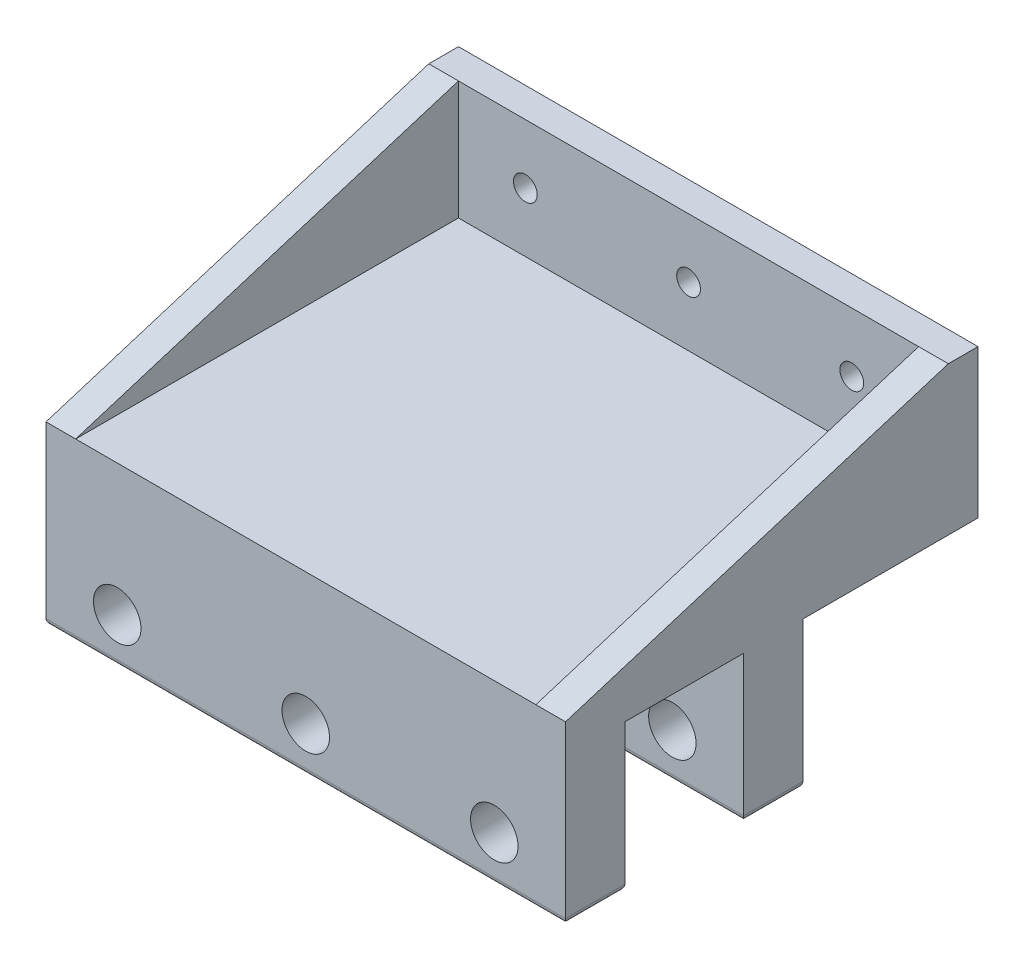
SolidWorks part; units mm, degrees
ref_plane "Front Plane" through (0, 0, 0) normal (0, 0, 1) x (1, 0, 0)
ref_plane "Top Plane" through (0, 0, 0) normal (0, 1, 0) x (1, 0, 0)
ref_plane "Right Plane" through (0, 0, 0) normal (1, 0, 0) x (0, 0, -1)
sketch "Sketch1" plane through (0, 0, 0) normal (0, 0, 1) x (1, 0, 0)
  line L0 (47.6629, 9.1457) -> (47.6644, 47.1838) construction
  line L1 (47.6629, -7.5399) -> (47.6629, 0)
  line L2 (15.8937, -7.5399) -> (79.4322, -7.5399)
  line L3 (47.6629, 9.1457) -> (47.6629, -7.5399)
  line L4 (47.6644, 47.1838) -> (135.2628, 47.1838) construction
  line L10 (91.4322, 22.1643) -> (91.4322, -7.5399)
  line L11 (91.4322, -7.5399) -> (79.4322, -7.5399)
  line L13 (3.8937, 22.1643) -> (3.8937, -7.5399)
  line L14 (3.8937, -7.5399) -> (15.8937, -7.5399)
  line L17 (3.8937, 17.1643) -> (3.8937, 22.1643)
  line L18 (3.8937, 22.1643) -> (91.4322, 22.1643)
  line L19 (91.4322, 22.1643) -> (91.4322, 17.1643)
  circle A3 centre (15.8937, 0) radius 4
  circle A4 centre (47.6629, 0) radius 4
  circle A5 centre (79.4322, 0) radius 4
  point P1 (47.6629, 22.1643)
  point P14 (47.6629, 85.2218)
  dimension "D2" = 8
  dimension "D4" = 87.5385
  dimension "D1" = 25.0195
  dimension "D5" = 5
extrude "Boss-Extrude1" add sketch "Sketch1" along normal blind 5
sketch "Sketch3" plane through (0, 0, 0) normal (0, 0, -1) x (-1, 0, 0)
  line L0 (-3.8937, 22.1643) -> (-3.8937, -7.5399) construction
  line L1 (-91.4322, 22.1643) -> (-3.8937, 22.1643)
  line L2 (-91.4322, 22.1643) -> (-91.4322, 17.1643)
  line L3 (-91.4322, 17.1643) -> (-3.8937, 17.1643)
  line L4 (-3.8937, 22.1643) -> (-3.8937, 17.1643)
  dimension "D1" = 5
extrude "Boss-Extrude2" add sketch "Sketch3" along normal blind 64.5
sketch "Sketch5" plane through (0, 0, -64.5) normal (0, 0, -1) x (-1, 0, 0)
  line L0 (-91.4322, 22.1643) -> (-91.4322, 42.1643)
  line L1 (-91.4322, 42.1643) -> (-3.8937, 42.1643)
  line L2 (-3.8937, 42.1643) -> (-3.8937, 22.1643)
  line L5 (-91.4322, 22.1643) -> (-3.8937, 22.1643)
  dimension "D1" = 20
extrude "Boss-Extrude3" add sketch "Sketch5" against normal blind 5
sketch "Sketch6" plane through (0, 17.1643, 0) normal (0, -1, 0) x (1, 0, 0)
  line L0 (47.6629, 0) -> (47.6629, -25) construction
  line L1 (91.4322, 0) -> (3.8937, 0) construction
  line L2 (3.8937, -25) -> (91.4322, -25)
  line L3 (91.4322, -64.5) -> (91.4322, 0) construction
  line L4 (3.8937, -25) -> (3.8937, -35)
  line L5 (3.8937, -64.5) -> (3.8937, 0) construction
  line L6 (3.8937, -35) -> (91.4322, -35)
  line L7 (91.4322, -35) -> (91.4322, -25)
  point P9 (47.6629, -25)
  dimension "D1" = 35
  dimension "D2" = 10
extrude "Boss-Extrude4" add sketch "Sketch6" along normal up to surface (24.7042 mm away) contours L7 L2 L4 L6
sketch "Sketch7" plane through (0, 0, -25) normal (0, 0, 1) x (1, 0, 0)
  line L4 (3.8937, -7.5399) -> (91.4322, -7.5399)
  line L5 (91.4322, -7.5399) -> (91.4322, 17.1643)
  line L6 (91.4322, 17.1643) -> (3.8937, 17.1643)
  line L7 (3.8937, 17.1643) -> (3.8937, -7.5399)
  line L8 (3.8937, -7.5399) -> (91.4322, -7.5399)
  line L9 (91.4322, -7.5399) -> (91.4322, 17.1643)
  line L10 (91.4322, 17.1643) -> (3.8937, 17.1643)
  line L11 (3.8937, 17.1643) -> (3.8937, -7.5399)
  circle A0 centre (79.4322, 0) radius 4 construction
  circle A1 centre (47.6629, 0) radius 4 construction
  circle A2 centre (15.8937, 0) radius 4 construction
  circle A3 centre (79.4322, 0) radius 4
  circle A4 centre (47.6629, 0) radius 4
  circle A5 centre (15.8937, 0) radius 4
  dimension "D1" = 0
extrude "Cut-Extrude1" cut sketch "Sketch7" against normal through all contours A5 | A4 | A3
sketch "Sketch8" plane through (0, 0, -59.5) normal (0, 0, 1) x (1, 0, 0)
  line L0 (3.8937, 22.1643) -> (91.4322, 22.1643) construction
  line L1 (3.8937, 42.1643) -> (8.8937, 42.1643)
  line L2 (3.8937, 42.1643) -> (3.8937, 22.1643)
  line L3 (3.8937, 22.1643) -> (8.8937, 22.1643)
  line L4 (8.8937, 42.1643) -> (8.8937, 22.1643)
  line L6 (91.4322, 42.1643) -> (86.4322, 42.1643)
  line L7 (91.4322, 42.1643) -> (91.4322, 22.1643)
  line L8 (91.4322, 22.1643) -> (86.4322, 22.1643)
  line L9 (86.4322, 42.1643) -> (86.4322, 22.1643)
  dimension "D1" = 5
  dimension "D2" = 5
extrude "Boss-Extrude5" add sketch "Sketch8" along normal up to surface (64.5 mm away) contours L2 L1 L4 L3 | L7 L6 L9 L8
sketch "Sketch9" plane through (91.4322, 0, 0) normal (1, 0, 0) x (0, 0, -1)
  line L0 (64.5, 17.1643) -> (64.5, 22.1643) construction
  line L1 (64.5, 42.1643) -> (64.5, 17.1643) construction
  line L2 (64.5, 22.1643) -> (-5, 22.1643) construction
  line L3 (-5, 42.1643) -> (-5, -7.5399) construction
  line L4 (-5, 22.1643) -> (-5, 42.1643)
  line L5 (-5, 42.1643) -> (64.5, 42.1643)
  line L7 (64.5, 42.1643) -> (59.5, 42.1643) construction
  line L8 (59.5, 42.1643) -> (-5, 22.1643)
  dimension "D1" = 5
  dimension "D2" = 5
extrude "Cut-Extrude3" cut sketch "Sketch9" against normal through all contours L8 L5 M10
sketch "Sketch10" plane through (0, 0, -59.5) normal (0, 0, 1) x (1, 0, 0)
  line L0 (8.8937, 32.1643) -> (86.4322, 32.1643) construction
  line L1 (8.8937, 42.1643) -> (8.8937, 22.1643) construction
  line L2 (86.4322, 42.1643) -> (86.4322, 22.1643) construction
  line L3 (20.1629, 32.1643) -> (75.1629, 32.1643)
  circle A0 centre (47.6629, 32.1643) radius 2
  circle A1 centre (20.1629, 32.1643) radius 2
  circle A2 centre (75.1629, 32.1643) radius 2
  point P11 (47.6629, 32.1643)
  dimension "D1" = 4
  dimension "D3" = 4
  dimension "D4" = 4
  dimension "D2" = 55
extrude "Cut-Extrude4" cut sketch "Sketch10" against normal through all contours L0 A1 L3 | A1 L0 L3 | L3 A0 | L3 A0 | L0 L3 A2 | L3 L0 A2
sketch "Sketch13" plane through (0, 17.1643, 0) normal (0, -1, 0) x (1, 0, 0)
  line L0 (91.4322, -25) -> (91.4322, 0) construction
  line L1 (3.8937, 0) -> (91.4322, 0)
  line L2 (3.8937, 0) -> (3.8937, -5)
  line L3 (3.8937, -5) -> (91.4322, -5)
  line L4 (91.4322, 0) -> (91.4322, -5)
  dimension "D1" = 5
extrude "Boss-Extrude6" add sketch "Sketch13" along normal up to surface (24.7042 mm away)
sketch "Sketch14" plane through (0, 0, -5) normal (0, 0, -1) x (-1, 0, 0)
  line L4 (-91.4322, 17.1643) -> (-91.4322, -7.5399)
  line L5 (-91.4322, -7.5399) -> (-3.8937, -7.5399)
  line L6 (-3.8937, -7.5399) -> (-3.8937, 17.1643)
  line L7 (-3.8937, 17.1643) -> (-91.4322, 17.1643)
  line L8 (-91.4322, 17.1643) -> (-91.4322, -7.5399)
  line L9 (-91.4322, -7.5399) -> (-3.8937, -7.5399)
  line L10 (-3.8937, -7.5399) -> (-3.8937, 17.1643)
  line L11 (-3.8937, 17.1643) -> (-91.4322, 17.1643)
  circle A0 centre (-79.4322, 0) radius 4 construction
  circle A1 centre (-15.8937, 0) radius 4 construction
  circle A2 centre (-47.6629, 0) radius 4 construction
  circle A3 centre (-79.4322, 0) radius 4
  circle A4 centre (-15.8937, 0) radius 4
  circle A5 centre (-47.6629, 0) radius 4
  dimension "D1" = 0
extrude "Cut-Extrude6" cut sketch "Sketch14" against normal through all contours A3 | A5 | A4
fillet "Fillet2" radius 1 8 edges at (47.6629, -7.5399, 5) (3.8937, -7.5399, -30) (3.8937, -7.5399, 0) (91.4322, -7.5399, -30) (91.4322, -7.5399, 0) (47.6629, -7.5399, -35) (47.6629, -7.5399, -25) (47.6629, -7.5399, -5)
